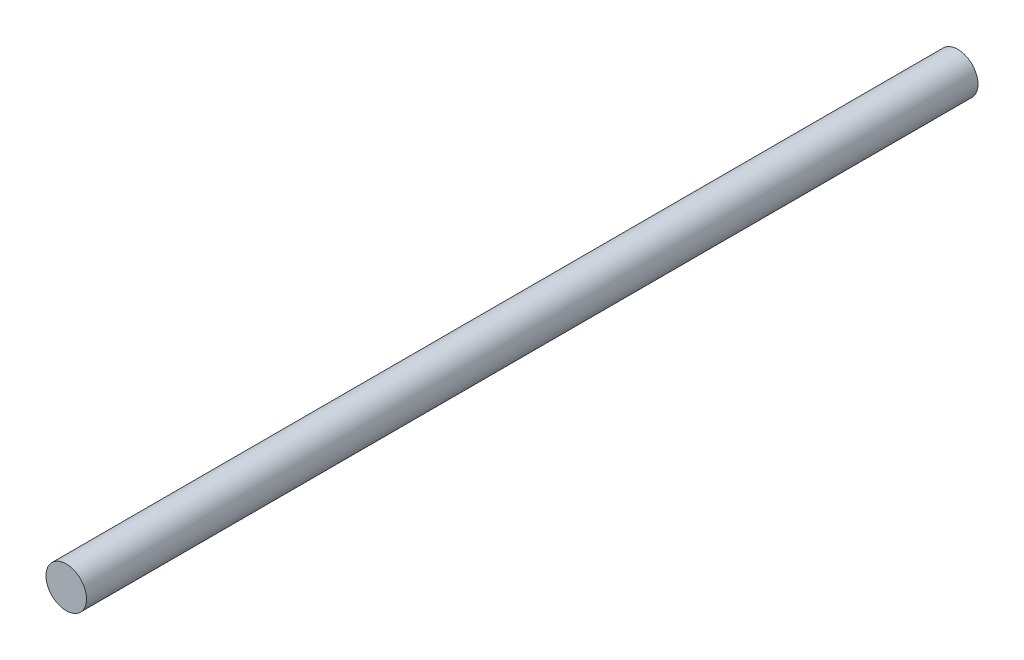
SolidWorks part; units mm, degrees
ref_plane "Front Plane" through (0, 0, 0) normal (0, 0, 1) x (1, 0, 0)
ref_plane "Top Plane" through (0, 0, 0) normal (0, 1, 0) x (1, 0, 0)
ref_plane "Right Plane" through (0, 0, 0) normal (1, 0, 0) x (0, 0, -1)
sketch "Sketch1" plane through (0, 0, 0) normal (0, 0, 1) x (1, 0, 0)
  circle A0 centre (0, 0) radius 3.175
  dimension "D1" = 6.35
extrude "Boss-Extrude1" add sketch "Sketch1" along normal mid plane 139.7
